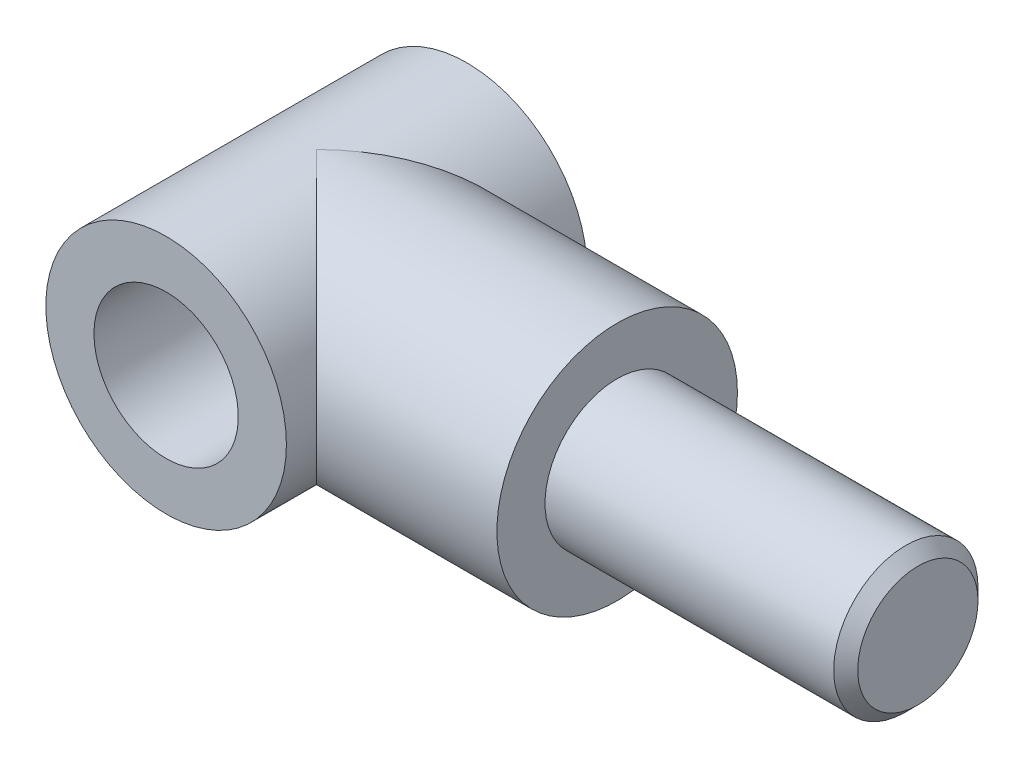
SolidWorks part; units mm, degrees
ref_plane "Plan1" through (0, 0, 0) normal (0, 0, 1) x (1, 0, 0)
ref_plane "Plan2" through (0, 0, 0) normal (0, 1, 0) x (1, 0, 0)
ref_plane "Plan3" through (0, 0, 0) normal (1, 0, 0) x (0, 0, -1)
sketch "Esquisse1" plane through (0, 0, 0) normal (0, 0, 1) x (1, 0, 0)
  circle A0 centre (0, 0) radius 10
  dimension "D1" = 20
extrude "Base-Extrusion" add sketch "Esquisse1" along normal blind 25
sketch "Esquisse2" plane through (0, 0, 0) normal (1, 0, 0) x (0, 0, -1)
  line L0 (-25, 0) -> (0, 0) construction
  line L1 (0, -10) -> (0, 10) construction
  circle A0 centre (-12.5, 0) radius 10
  dimension "D2" = 20
  dimension "D1" = 12.5
extrude "Boss.-Extru.1" add sketch "Esquisse2" along normal blind 25
sketch "Esquisse3" plane through (0, 0, 0) normal (0, 0, -1) x (-1, 0, 0)
  circle A0 centre (0, 0) radius 6
  circle A1 centre (0, 0) radius 10 construction
  dimension "D1" = 12
extrude "Enlèv. mat.-Extru.1" cut sketch "Esquisse3" against normal through all
sketch "Esquisse4" plane through (25, 0, 0) normal (1, 0, 0) x (0, 0, -1)
  line L0 (-25, 0) -> (0, 0) construction
  circle A0 centre (-12.5, 0) radius 6
  circle A1 centre (-12.5, 0) radius 10 construction
  dimension "D1" = 12
extrude "Boss.-Extru.2" add sketch "Esquisse4" along normal blind 25
chamfer "Chanfrein1" distance 1 angle 45
